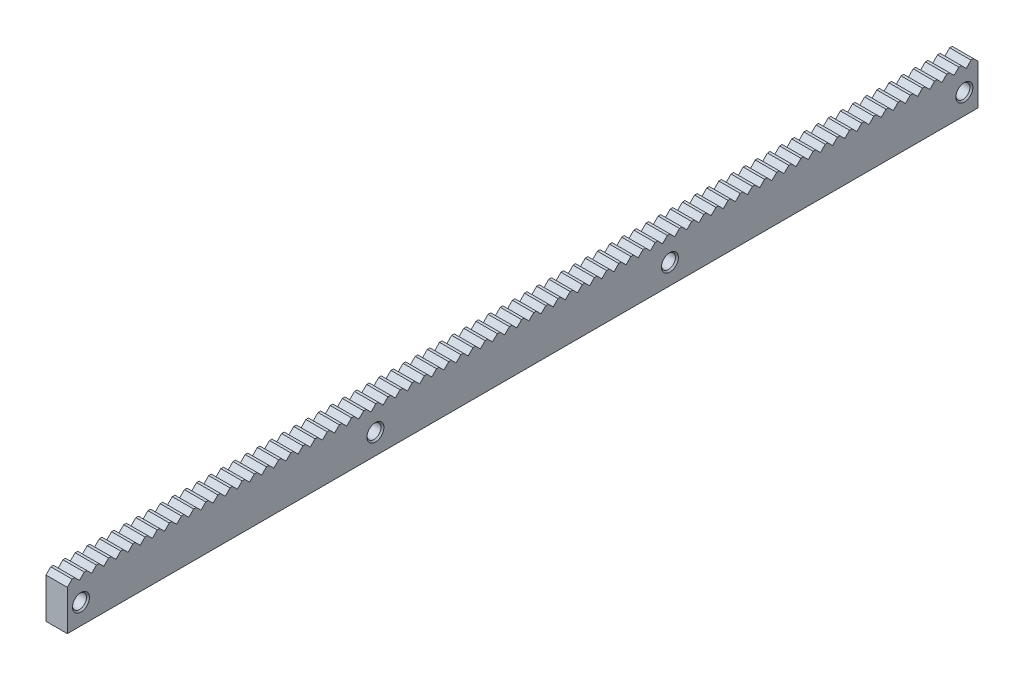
SolidWorks part; units mm, degrees
ref_plane "Front Plane" through (0, 0, 0) normal (0, 0, 1) x (1, 0, 0)
ref_plane "Top Plane" through (0, 0, 0) normal (0, 1, 0) x (1, 0, 0)
ref_plane "Right Plane" through (0, 0, 0) normal (1, 0, 0) x (0, 0, -1)
sketch "Sketch1" plane through (0, 0, 0) normal (1, 0, 0) x (0, 0, -1)
  line L1 (123.7, -6.1) -> (-123.7, -6.1)
  line L2 (123.7, -6.1) -> (123.7, 6.1)
  line L3 (123.7, 6.1) -> (-123.7, 6.1)
  line L4 (-123.7, -6.1) -> (-123.7, 6.1)
  line L5 (123.7, -6.1) -> (-123.7, 6.1) construction
  line L6 (123.7, 6.1) -> (-123.7, -6.1) construction
  point P0 (0, 0)
  dimension "D1" = 247.4
  dimension "D2" = 12.2
extrude "Boss-Extrude1" add sketch "Sketch1" along normal mid plane 5.8
sketch "Sketch2" plane through (0, 0, 0) normal (1, 0, 0) x (0, 0, -1)
  line L0 (-123.7, 4.8) -> (-125, 6.1)
  line L1 (-123.7, 6.1) -> (-123.7, -6.1) construction
  line L2 (-125, 6.1) -> (-122.4, 6.1)
  line L3 (123.7, 6.1) -> (-123.7, 6.1) construction
  line L4 (-122.4, 6.1) -> (-123.7, 4.8)
  line L5 (-123.7, -6.1) -> (123.7, -6.1) construction
  point P8 (-123.7, 4.8)
  dimension "D1" = 10.9
extrude "Cut-Extrude1" cut sketch "Sketch2" against normal mid plane 5.8
pattern_linear "LPattern1" count 76 spacing 3.3 along (0, -0.7071, -0.7071) of "Cut-Extrude1"
sketch "Sketch3" plane through (0, 0, 0) normal (1, 0, 0) x (0, 0, -1)
  line L0 (-123.7, -6.1) -> (123.7, -6.1) construction
  line L1 (-123.7, 4.8) -> (-123.7, -6.1) construction
  circle A0 centre (-120, -0.56) radius 1.9
  dimension "D3" = 3.8
  dimension "D1" = 5.54
  dimension "D2" = 3.7
extrude "Cut-Extrude2" cut sketch "Sketch3" against normal mid plane 5.8
chamfer "Chamfer1" distance 0.4 angle 45 2 edges at (-2.9, -0.56, 118.1) (2.9, -0.56, 118.1)
pattern_linear "LPattern2" count 4 spacing 80 along (0, 0, -1) of "Cut-Extrude2", "Chamfer1"
